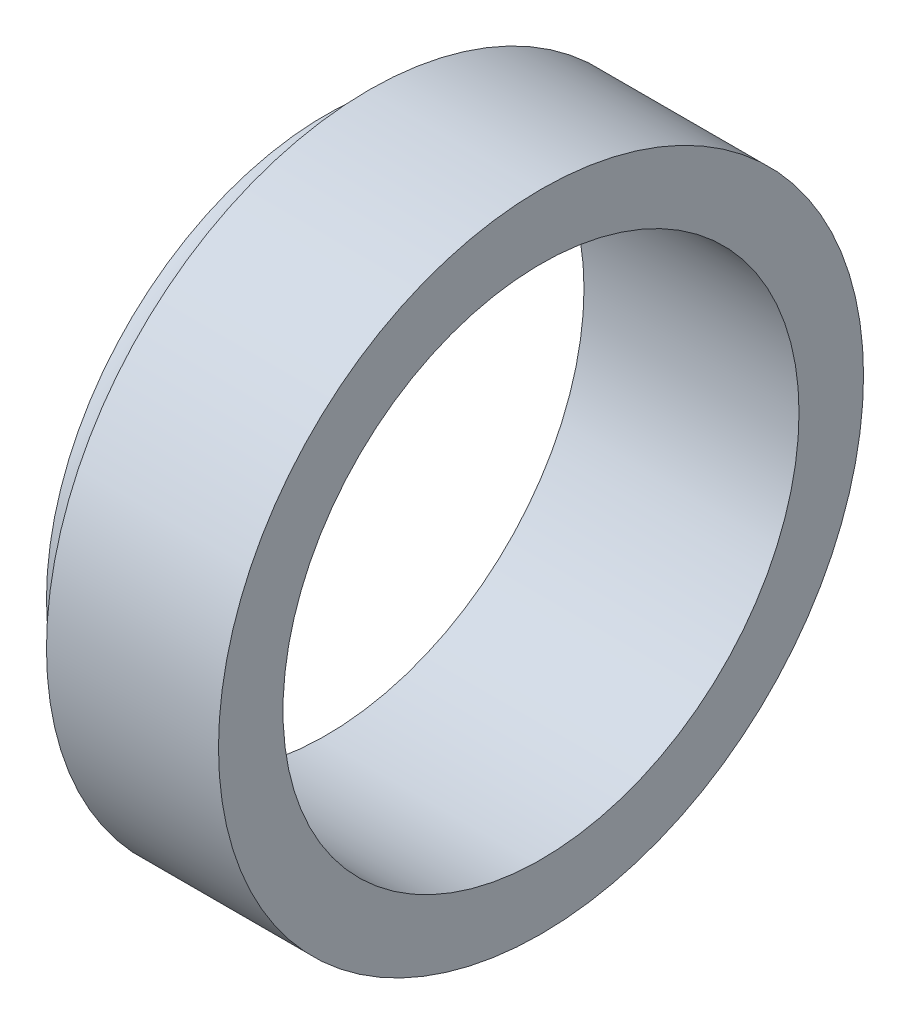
SolidWorks part; units mm, degrees
ref_plane "Plan de face" through (0, 0, 0) normal (0, 0, 1) x (1, 0, 0)
ref_plane "Plan de dessus" through (0, 0, 0) normal (0, 1, 0) x (1, 0, 0)
ref_plane "Plan de droite" through (0, 0, 0) normal (1, 0, 0) x (0, 0, -1)
sketch "Esquisse1" plane through (0, 0, 0) normal (0, 0, 1) x (1, 0, 0)
  line L0 (0, 6) -> (0, 6.5)
  line L1 (1, 7.5) -> (5, 7.5)
  line L2 (5, 7.5) -> (5, 6)
  line L3 (5, 6) -> (0, 6)
  line L4 (0, 0) -> (-2.7407, 0) construction
  arc A0 (0, 6.5) -> (1, 7.5) centre (0, 7.5) ccw
  dimension "D4" = 1
  dimension "D1" = 5
  dimension "D2" = 12
  dimension "D3" = 15
revolve "Révolution1" add sketch "Esquisse1" angle 360 about L4
